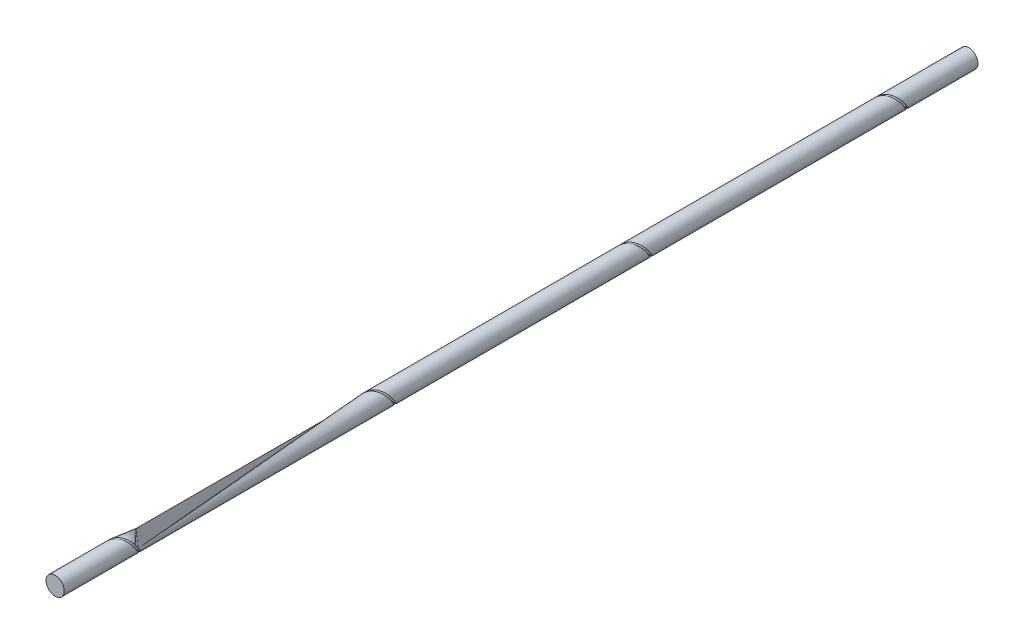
SolidWorks part; units mm, degrees
ref_plane "Front Plane" through (0, 0, 0) normal (0, 0, 1) x (1, 0, 0)
ref_plane "Top Plane" through (0, 0, 0) normal (0, 1, 0) x (1, 0, 0)
ref_plane "Right Plane" through (0, 0, 0) normal (1, 0, 0) x (0, 0, -1)
sketch "Sketch1" plane through (0, 0, 0) normal (0, 0, 1) x (1, 0, 0)
  circle A0 centre (0, 0) radius 25
  dimension "D1" = 50
extrude "Boss-Extrude1" add sketch "Sketch1" along normal blind 2500
ref_plane "Plane1" through (0, 0, 150) normal (0, 0, 1) x (1, 0, 0)
sketch "Sketch2" plane through (0, 0, 150) normal (0, 0, 1) x (1, 0, 0)
  circle A0 centre (0, 0) radius 27.646
  dimension "D1" = 55.292
curve "Helix/Spiral1"
sketch "Sketch3" plane through (0, 0, 0) normal (0, 1, 0) x (1, 0, 0)
  circle A0 centre (-27.646, -150) radius 3.969
  spline S0 degree 3 poles (-27.646, -150) (-27.646, -151.3307) (-27.0608, -154.0012) (-24.4828, -157.9997) (-20.3663, -162.0001) (-14.9702, -166) (-8.6335, -170) (-1.7543, -174) (5.2352, -178) (11.8957, -182) (17.8087, -186) (22.6028, -190) (25.9766, -194) (27.7183, -198) (27.7183, -202) (25.9766, -206) (22.6028, -210) (17.8087, -214) (11.8957, -218) (5.2352, -222) (-1.7543, -226) (-8.6335, -230) (-14.9702, -234) (-20.3663, -237.9999) (-24.4828, -242.0003) (-27.0608, -245.9988) (-27.646, -248.6693) (-27.646, -250) knots 0 0 0 0 0.04 0.08 0.12 0.16 0.2 0.24 0.28 0.32 0.36 0.4 0.44 0.48 0.52 0.56 0.6 0.64 0.68 0.72 0.76 0.8 0.84 0.88 0.92 0.96 1 1 1 1 construction
  dimension "D1" = 7.938
sweep "Cut-Sweep1" cut profiles "Sketch3" path "Helix/Spiral1"
pattern_linear "LPattern1" count 4 spacing 700 along (0, 0, -1) of "Cut-Sweep1"
